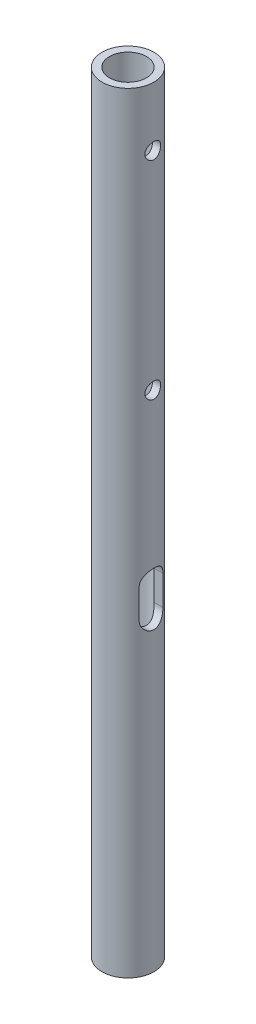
SolidWorks part; units mm, degrees
ref_plane "Front Plane" through (0, 0, 0) normal (0, 0, 1) x (1, 0, 0)
ref_plane "Top Plane" through (0, 0, 0) normal (0, 1, 0) x (1, 0, 0)
ref_plane "Right Plane" through (0, 0, 0) normal (1, 0, 0) x (0, 0, -1)
sketch "Sketch1" plane through (0, 0, 0) normal (0, 1, 0) x (1, 0, 0)
  circle A0 centre (0, 0) radius 7.9375
  circle A1 centre (0, 0) radius 11.1125
  dimension "D1" = 15.875
  dimension "D2" = 22.225
extrude "Extrude1" add sketch "Sketch1" along normal blind 330.2
sketch "Sketch7" plane through (0, 0, 0) normal (1, 0, 0) x (0, 0, -1)
  line L2 (11.1125, 330.2) -> (-11.1125, 330.2) construction
  line L3 (11.1125, 0) -> (11.1125, 330.2) construction
  circle A0 centre (0, 304.8) radius 3.3782
  circle A1 centre (0, 215.9) radius 3.3782
  dimension "D1" = 6.7564
  dimension "D2" = 6.7564
  dimension "D3" = 88.9
  dimension "D4" = 25.4
  dimension "D5" = 11.1125
extrude "Cut-Extrude7" cut sketch "Sketch7" along normal through all contours A1 | A0
sketch "Sketch10" plane through (0, 0, 0) normal (1, 0, 0) x (0, 0, -1)
  circle A0 centre (0, 304.8) radius 6.3758
  circle A1 centre (0, 215.9) radius 6.35
  dimension "D1" = 12.7516
extrude "Cut-Extrude8" cut sketch "Sketch10" against normal through all
sketch "Sketch11" plane through (0, 0, 0) normal (1, 0, 0) x (0, 0, -1)
  line L0 (5.08, 144.78) -> (5.08, 132.08)
  line L1 (-5.08, 132.08) -> (-5.08, 144.78)
  line L2 (-11.1125, 0) -> (11.1125, 0) construction
  arc A0 (-5.08, 132.08) -> (5.08, 132.08) centre (0, 132.08) ccw
  arc A1 (5.08, 144.78) -> (-5.08, 144.78) centre (0, 144.78) ccw
  dimension "D1" = 10.16
  dimension "D2" = 10.16
  dimension "D3" = 12.7
  dimension "D4" = 132.08
  dimension "D5" = 5.08
extrude "Cut-Extrude9" cut sketch "Sketch11" along normal through all and the other way through all
